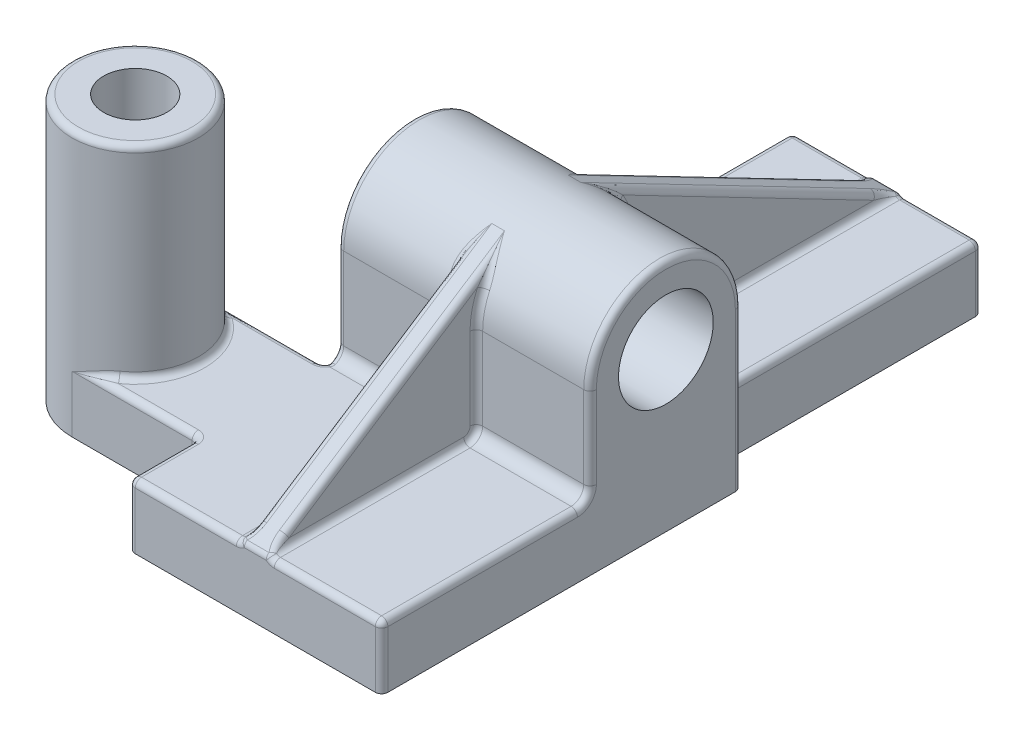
SolidWorks part; units mm, degrees
ref_plane "Front Plane" through (0, 0, 0) normal (0, 0, 1) x (1, 0, 0)
ref_plane "Top Plane" through (0, 0, 0) normal (0, 1, 0) x (1, 0, 0)
ref_plane "Right Plane" through (0, 0, 0) normal (1, 0, 0) x (0, 0, -1)
sketch "Sketch1" plane through (0, 0, 0) normal (0, 1, 0) x (1, 0, 0)
  line L0 (0, 100) -> (0, 0) construction
  line L1 (-20, 0) -> (20, 0)
  line L2 (-20, 0) -> (-20, 57)
  line L3 (-20, 57) -> (-15, 57)
  line L4 (20, 0) -> (20, 57)
  line L6 (-15, 57) -> (-15, 100)
  line L7 (-15, 100) -> (15, 100)
  line L8 (15, 57) -> (15, 100)
  line L9 (15, 57) -> (20, 57)
  dimension "D1" = 100
  dimension "D2" = 57
  dimension "D3" = 40
  dimension "D4" = 30
extrude "Extrude1" add sketch "Sketch1" along normal blind 10
sketch "Sketch2" plane through (20, 0, 0) normal (1, 0, 0) x (0, 0, -1)
  line L0 (57, 10) -> (57, 25)
  line L1 (33, 10) -> (33, 25)
  line L3 (0, 10) -> (57, 10) construction
  line L8 (33, 10) -> (57, 10)
  line L10 (0, 0) -> (57, 0) construction
  arc A0 (33, 25) -> (57, 25) centre (45, 25) cw
  dimension "D1" = 12
  dimension "D2" = 25
extrude "Extrude2" add sketch "Sketch2" against normal up to vertex
sketch "Sketch5" plane through (0, 0, 0) normal (0, 1, 0) x (1, 0, 0)
  line L0 (-20, 33) -> (-20, 0) construction
  line L1 (-20, 11) -> (-40, 11)
  line L2 (-20, 11) -> (-20, 31)
  line L3 (-20, 31) -> (-40, 31)
  line L4 (20, 0) -> (20, 33) construction
  line L5 (-20, 0) -> (20, 0) construction
  arc A0 (-40, 31) -> (-40, 11) centre (-40, 21) ccw
  dimension "D1" = 21
  dimension "D3" = 20
  dimension "D2" = 60
extrude "Extrude3" add sketch "Sketch5" along normal up to vertex
sketch "Sketch6" plane through (0, 0, 0) normal (0, 1, 0) x (1, 0, 0)
  circle A0 centre (-40, 21) radius 10
  arc A1 (-40, 31) -> (-40, 11) centre (-40, 21) ccw construction
extrude "Extrude4" add sketch "Sketch6" along normal blind 42
sketch "Sketch3" plane through (0, 0, 0) normal (1, 0, 0) x (0, 0, -1)
  line L0 (0, 10) -> (38.4487, 35.0539)
  line L1 (100, 10) -> (50.5236, 35.6532) construction
  arc A0 (57, 25) -> (33, 25) centre (45, 25) ccw construction
rib "Rib3" sketch "Sketch3" sketch "Sketch3" thickness 4 extrusion direction parallel to sketch draft on no parameters "D1"=4
sketch "Sketch4" plane through (0, 0, 0) normal (1, 0, 0) x (0, 0, -1)
  line L0 (100, 10) -> (50.5236, 35.6532) construction
  line L1 (100, 10) -> (50.5236, 35.6532)
rib "Rib4" sketch "Sketch4" sketch "Sketch4" thickness 4 extrusion direction parallel to sketch draft on no parameters "D1"=4
hole_wizard "Ø10.0 (10) Diameter Hole1" positions "Sketch8" profile "Sketch7" hole size "Ø10.0" standard "Ansi Metric"
sketch "Sketch8" plane through (0, 42, 0) normal (0, 1, 0) x (-1, 0, 0)
  point P0 (40, -21)
sketch "Sketch7" plane through (-40, 42, -21) normal (1, 0, 0) x (0, 0, 1)
  line L0 (0, 0) -> (0, 42.0001)
  line L1 (0, 42.0001) -> (5, 42.0001)
  line L2 (5, 42.0001) -> (5, 0)
  line L5 (5, 0) -> (0, 0)
  line L11 (0, -6.35) -> (0, 107.95) construction
  dimension "Thru Hole Dia." = 10
  dimension "Thru Hole Depth" = 42.0001
hole_wizard "Ø15.0 (15) Diameter Hole1" positions "Sketch9" profile "Sketch10" hole size "Ø15.0" standard "Ansi Metric"
sketch "Sketch9" plane through (20, 0, 0) normal (1, 0, 0) x (0, 1, 0)
  arc A0 (25, -57) -> (25, -33) centre (25, -45) ccw construction
  point P0 (25, -45)
sketch "Sketch10" plane through (20, 25, -45) normal (0, 1, 0) x (0, 0, -1)
  line L0 (0, 0) -> (0, 70)
  line L1 (0, 70) -> (7.5, 70)
  line L2 (7.5, 70) -> (7.5, 0)
  line L5 (7.5, 0) -> (0, 0)
  line L11 (0, -6.35) -> (0, 107.95) construction
  dimension "Thru Hole Dia." = 15
  dimension "Thru Hole Depth" = 70
fillet "Fillet2" radius 2 2 edges
fillet "Fillet1" radius 1 52 edges at (2, 30.7177, -34.4498) (-2, 30.7177, -34.4498) (-20, 5, 0) (20, 5, 0) (20, 12.5, -57) (15, 5, -100) (-15, 5, -100) (-20, 12.5, -57) (8.5, 10, -100) (-8.5, 10, -100) (-11, 10, 0) (11, 10, 0) (2, 18.5, -33) (-2, 18.5, -33) (-20, 37, -45) (20, 37, -45) (-30, 10, -21) (-40, 42, -11) (0, 10, 0) (2, 10, -15.5) (-2, 10, -15.5) (2, 22.5269, -19.2244) (-2, 22.5269, -19.2244) (0, 10, -100) (2, 10, -78.5) (2, 17.5, -57) (2, 31.2337, -55.2539) (-2, 31.2337, -55.2539) (-2, 17.5, -57) (-2, 10, -78.5) (2, 22.8266, -75.2618) (-2, 22.8266, -75.2618) (-40, 0, -26) (20, 10.5858, -32.4142) (-2, 10.5858, -32.4142) (2, 10.5858, -32.4142)
